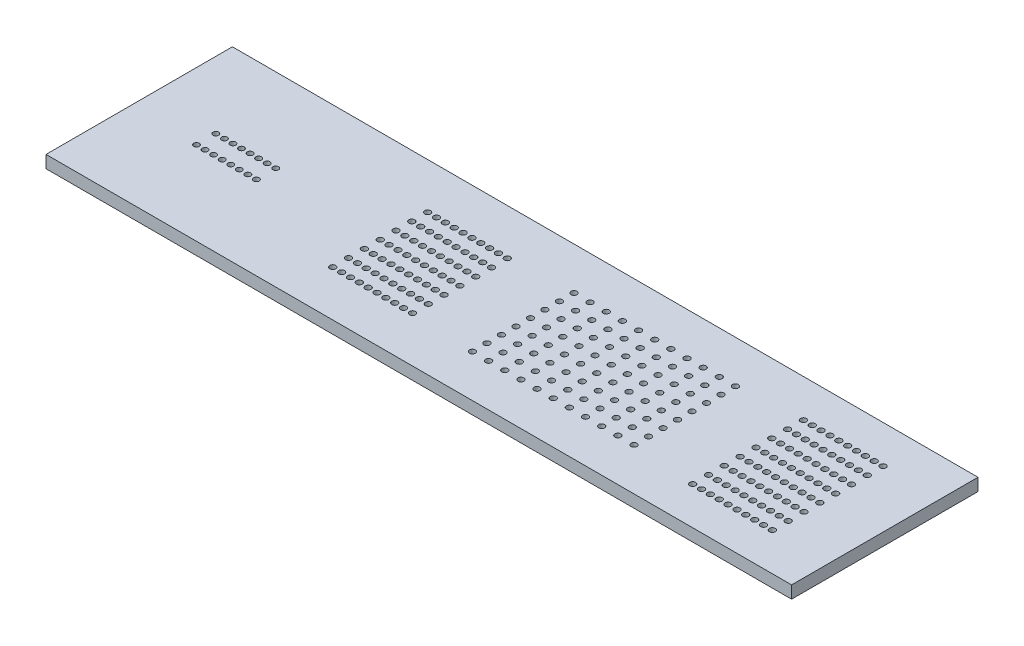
SolidWorks part; units mm, degrees
ref_plane "Plan de face" through (0, 0, 0) normal (0, 0, 1) x (1, 0, 0)
ref_plane "Plan de dessus" through (0, 0, 0) normal (0, 1, 0) x (1, 0, 0)
ref_plane "Plan de droite" through (0, 0, 0) normal (1, 0, 0) x (0, 0, -1)
sketch "Esquisse2" plane through (0, 0, 0) normal (0, 1, 0) x (1, 0, 0)
  line L1 (-60, -15) -> (60, -15)
  line L2 (-60, -15) -> (-60, 15)
  line L3 (-60, 15) -> (60, 15)
  line L4 (60, -15) -> (60, 15)
  line L5 (-60, -15) -> (60, 15) construction
  line L6 (-60, 15) -> (60, -15) construction
  point P0 (0, 0)
  dimension "D1" = 30
  dimension "D2" = 120
extrude "Boss.-Extru.1" add sketch "Esquisse2" along normal blind 2 contours L3 L4 L1 L2
sketch "Cavités" plane through (0, 0, 0) normal (0, 1, 0) x (1, 0, 0)
  line L0 (-60, -15) -> (60, -15) construction
  line L1 (-58.4, 15) -> (-30.4, 15) construction
  line L2 (-58.4, 15) -> (-58.4, -15) construction
  line L3 (-58.4, -15) -> (-30.4, -15) construction
  line L4 (-30.4, 15) -> (-30.4, -15) construction
  line L5 (-60, 15) -> (60, 15) construction
  line L6 (-28.8, 15) -> (-0.8, 15) construction
  line L7 (-28.8, 15) -> (-28.8, -15) construction
  line L8 (-28.8, -15) -> (-0.8, -15) construction
  line L9 (-0.8, 15) -> (-0.8, -15) construction
  line L10 (-30.4, 15) -> (-28.8, 15) construction
  line L11 (0.8, 15) -> (28.8, 15) construction
  line L12 (0.8, 15) -> (0.8, -15) construction
  line L13 (0.8, -15) -> (28.8, -15) construction
  line L14 (28.8, 15) -> (28.8, -15) construction
  line L15 (30.4, 15) -> (58.4, 15) construction
  line L16 (30.4, 15) -> (30.4, -15) construction
  line L17 (30.4, -15) -> (58.4, -15) construction
  line L18 (58.4, 15) -> (58.4, -15) construction
  line L19 (-0.8, 15) -> (0.8, 15) construction
  line L20 (28.8, 15) -> (30.4, 15) construction
  line L21 (-60, 15) -> (-58.4, 15) construction
  line L22 (58.4, 15) -> (60, 15) construction
  dimension "D1" = 28
  dimension "D2" = 1.6
sketch "Esquisse7" plane through (0, 2, 0) normal (0, 1, 0) x (1, 0, 0)
  line L0 (-58.4, 0) -> (-49.2195, 0) construction
  line L1 (-49.2195, 1.5555) -> (-39.5805, 1.5555) construction
  line L2 (-49.2195, 1.5555) -> (-49.2195, -1.5555) construction
  line L3 (-49.2195, -1.5555) -> (-39.5805, -1.5555) construction
  line L4 (-39.5805, 1.5555) -> (-39.5805, -1.5555) construction
  line L5 (-58.4, 15) -> (-58.4, -15) construction
  line L6 (-39.5805, 0) -> (-30.4, 0) construction
  line L7 (-30.4, 15) -> (-30.4, -15) construction
  dimension "D1" = 9.639
  dimension "D2" = 3.111
sketch "Esquisse8" plane through (0, 2, 0) normal (0, 1, 0) x (1, 0, 0)
  circle A0 centre (-49.2195, 1.5555) radius 0.45
  dimension "D1" = 0.9
extrude "Enlèv. mat.-Extru.3" cut sketch "Esquisse8" against normal up to next
pattern_linear "Répétition linéaire4" count 8 spacing 1.377 along (1, 0, 0) count 2 spacing 3.111 along (0, 0, 1) of "Enlèv. mat.-Extru.3"
sketch "Esquisse9" plane through (0, 2, 0) normal (0, 1, 0) x (1, 0, 0)
  line L0 (-28.8, 0) -> (-21.2125, 0) construction
  line L1 (-21.2125, 7.635) -> (-8.3875, 7.635) construction
  line L2 (-21.2125, 7.635) -> (-21.2125, -7.635) construction
  line L3 (-21.2125, -7.635) -> (-8.3875, -7.635) construction
  line L4 (-8.3875, 7.635) -> (-8.3875, -7.635) construction
  line L5 (-28.8, 15) -> (-28.8, -15) construction
  line L6 (-8.3875, 0) -> (-0.8, 0) construction
  line L7 (-0.8, 15) -> (-0.8, -15) construction
  dimension "D1" = 12.825
  dimension "D2" = 15.27
sketch "Esquisse10" plane through (0, 2, 0) normal (0, 1, 0) x (1, 0, 0)
  circle A0 centre (-21.2125, 7.635) radius 0.475
  dimension "D1" = 0.95
extrude "Enlèv. mat.-Extru.4" cut sketch "Esquisse10" against normal up to next
pattern_linear "Répétition linéaire5" count 10 spacing 1.425 along (1, 0, 0) count 7 spacing 2.545 along (0, 0, 1) of "Enlèv. mat.-Extru.4"
sketch "Esquisse11" plane through (0, 2, 0) normal (0, 1, 0) x (1, 0, 0)
  line L0 (0.8, 0) -> (1.8, 0) construction
  line L1 (1.8, 8.1655) -> (27.8, 8.1655) construction
  line L2 (1.8, 8.1655) -> (1.8, -8.1655) construction
  line L3 (1.8, -8.1655) -> (27.8, -8.1655) construction
  line L4 (27.8, 8.1655) -> (27.8, -8.1655) construction
  line L5 (0.8, 15) -> (0.8, -15) construction
  line L6 (27.8, 0) -> (28.8, 0) construction
  line L7 (28.8, 15) -> (28.8, -15) construction
  dimension "D1" = 26
  dimension "D2" = 16.331
sketch "Esquisse12" plane through (0, 2, 0) normal (0, 1, 0) x (1, 0, 0)
  circle A0 centre (1.8, 8.1655) radius 0.475
  dimension "D1" = 0.95
extrude "Enlèv. mat.-Extru.5" cut sketch "Esquisse12" against normal up to next
pattern_linear "Répétition linéaire6" count 11 spacing 2.6 along (1, 0, 0) count 8 spacing 2.333 along (0, 0, 1) of "Enlèv. mat.-Extru.5"
sketch "Esquisse13" plane through (0, 2, 0) normal (0, 1, 0) x (1, 0, 0)
  line L0 (30.4, 0) -> (37.9875, 0) construction
  line L1 (37.9875, 8.9075) -> (50.8125, 8.9075) construction
  line L2 (37.9875, 8.9075) -> (37.9875, -8.9075) construction
  line L3 (37.9875, -8.9075) -> (50.8125, -8.9075) construction
  line L4 (50.8125, 8.9075) -> (50.8125, -8.9075) construction
  line L5 (30.4, 15) -> (30.4, -15) construction
  line L6 (50.8125, 0) -> (58.4, 0) construction
  line L7 (58.4, 15) -> (58.4, -15) construction
  dimension "D1" = 17.815
  dimension "D2" = 12.825
sketch "Esquisse14" plane through (0, 2, 0) normal (0, 1, 0) x (1, 0, 0)
  circle A0 centre (37.9875, 8.9075) radius 0.475
  dimension "D1" = 0.95
extrude "Enlèv. mat.-Extru.6" cut sketch "Esquisse14" against normal up to next
pattern_linear "Répétition linéaire7" count 10 spacing 1.425 along (1, 0, 0) count 8 spacing 2.545 along (0, 0, 1) of "Enlèv. mat.-Extru.6"
